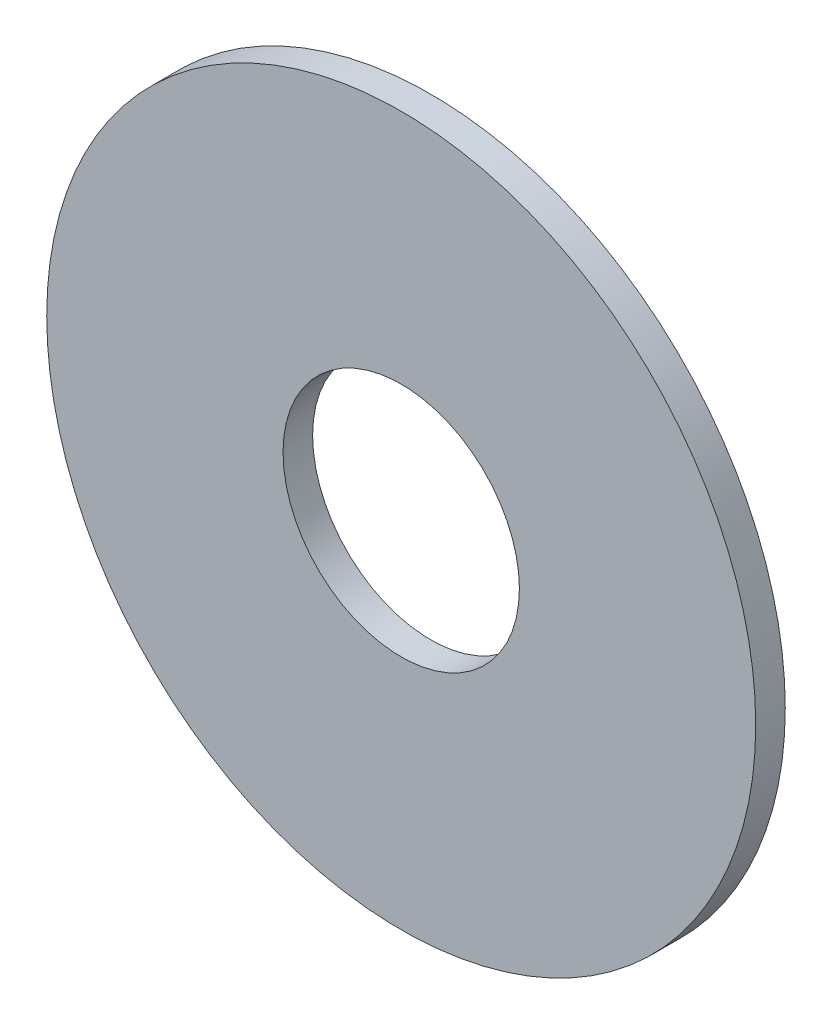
SolidWorks part; units mm, degrees
ref_plane "Плоскость1" through (0, 0, 0) normal (0, 0, 1) x (1, 0, 0)
ref_plane "Плоскость2" through (0, 0, 0) normal (0, 1, 0) x (1, 0, 0)
ref_plane "Плоскость3" through (0, 0, 0) normal (1, 0, 0) x (0, 0, -1)
sketch "Эскиз1" plane through (0, 0, 0) normal (0, 0, 1) x (1, 0, 0)
  circle A0 centre (-10, -20) radius 4
  circle A1 centre (-10, -20) radius 12
  dimension "D1" = 8
  dimension "D2" = 24
extrude "Основание-Вытянуть" add sketch "Эскиз1" along normal blind 1
